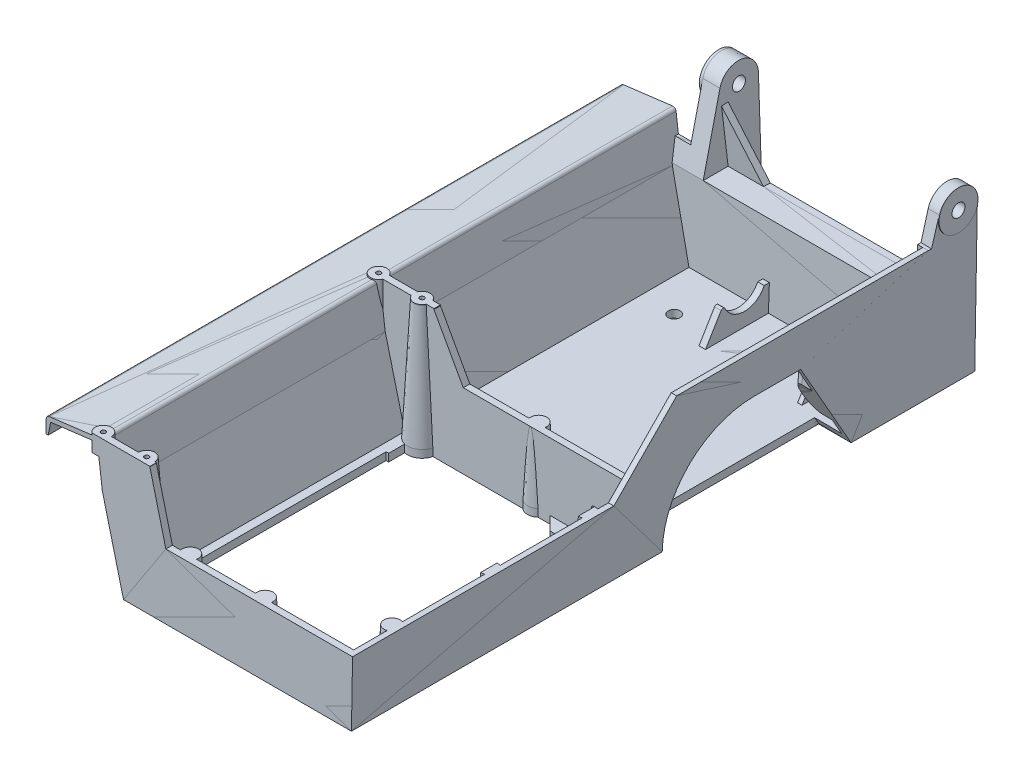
SolidWorks part; units mm, degrees
ref_plane "Plan de face" through (0, 0, 0) normal (0, 0, 1) x (1, 0, 0)
ref_plane "Plan de dessus" through (0, 0, 0) normal (0, 1, 0) x (1, 0, 0)
ref_plane "Plan de droite" through (0, 0, 0) normal (1, 0, 0) x (0, 0, -1)
imported_body "Importée1"
sketch "Esquisse1" plane through (0, 7, 0) normal (0, 1, 0) x (-1, 0, 0)
  line L0 (207.8786, 10.7434) -> (207.8786, 267) construction
  line L1 (29.3595, 72.794) -> (197.8786, 72.794)
  line L2 (29.3595, 72.794) -> (29.3595, 243.0547)
  line L3 (29.3595, 243.0547) -> (197.8786, 243.0547)
  line L4 (197.8786, 72.794) -> (197.8786, 243.0547)
  dimension "D1" = 10
extrude "Enlèv. mat.-Extru.1" cut sketch "Esquisse1" against normal through all
